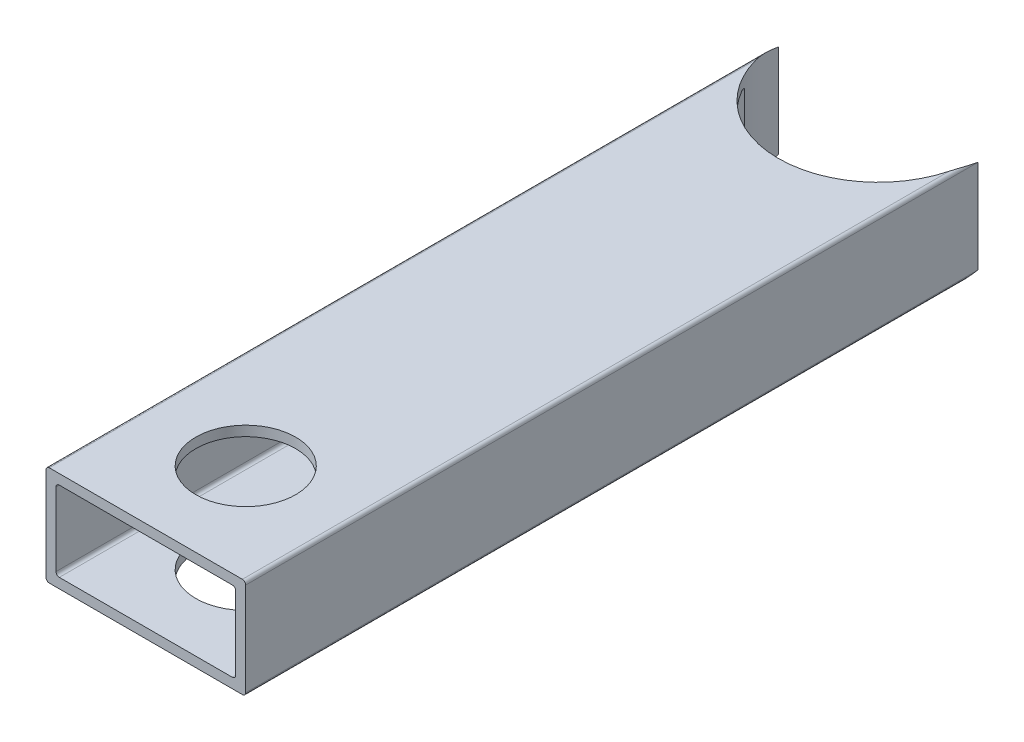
SolidWorks part; units mm, degrees
ref_plane "Plan de face" through (0, 0, 0) normal (0, 0, 1) x (1, 0, 0)
ref_plane "Plan de dessus" through (0, 0, 0) normal (0, 1, 0) x (1, 0, 0)
ref_plane "Plan de droite" through (0, 0, 0) normal (1, 0, 0) x (0, 0, -1)
sketch "Esquisse1" plane through (0, 0, 0) normal (0, 0, 1) x (1, 0, 0)
  line L0 (4, 27) -> (56, 27)
  line L1 (1, 0) -> (59, 0)
  line L2 (0, 1) -> (0, 29)
  line L3 (1, 30) -> (59, 30)
  line L4 (60, 1) -> (60, 29)
  line L5 (57, 4) -> (57, 26)
  line L6 (4, 3) -> (56, 3)
  line L7 (3, 4) -> (3, 26)
  line L8 (3, 3) -> (3, 27) construction
  line L9 (3, 27) -> (57, 27) construction
  line L10 (3, 3) -> (57, 3) construction
  line L11 (57, 3) -> (57, 27) construction
  arc A1 (56, 27) -> (57, 26) centre (56, 26) cw
  arc A2 (57, 4) -> (56, 3) centre (56, 4) cw
  arc A3 (60, 1) -> (59, 0) centre (59, 1) cw
  arc A4 (0, 1) -> (1, 0) centre (1, 1) ccw
  arc A5 (1, 30) -> (0, 29) centre (1, 29) ccw
  arc A6 (3, 4) -> (4, 3) centre (4, 4) ccw
  arc A7 (60, 29) -> (59, 30) centre (59, 29) ccw
  arc A8 (3, 26) -> (4, 27) centre (4, 26) cw
  arc A9 (3, 27) -> (3, 27) centre (3, 27) ccw construction
  arc A10 (3, 3) -> (3, 3) centre (3, 3) ccw construction
  arc A11 (57, 3) -> (57, 3) centre (57, 3) cw construction
  arc A12 (57, 27) -> (57, 27) centre (57, 27) ccw construction
  dimension "D4" = 1
  dimension "D3" = 1
  dimension "D5" = 1
  dimension "D6" = 1
  dimension "D8" = 1
  dimension "D1" = 30
  dimension "D2" = 60
  dimension "D7" = 3
extrude "Extrusion1" add sketch "Esquisse1" along normal blind 220
sketch "Esquisse3" plane through (0, 30, 0) normal (0, 1, 0) x (-1, 0, 0)
  line L0 (0, 220) -> (0, 0) construction
  line L1 (-59, 0) -> (-1, 0) construction
  circle A0 centre (-30, 0) radius 30
  dimension "D1" = 60
extrude "Enlèv. mat.-Extru.2" cut sketch "Esquisse3" against normal through all
sketch "Esquisse4" plane through (0, 30, 0) normal (0, 1, 0) x (-1, 0, 0)
  circle A0 centre (-30, 190) radius 15
  arc A1 (-1, 7.6811) -> (-59, 7.6811) centre (-30, 0) ccw construction
  dimension "D1" = 30
  dimension "D2" = 190
  dimension "D3" = 30
extrude "Enlèv. mat.-Extru.3" cut sketch "Esquisse4" against normal through all
